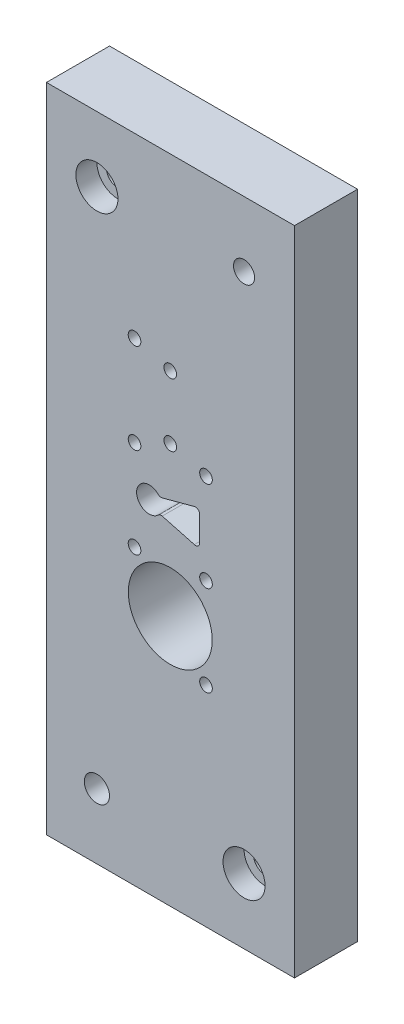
SolidWorks part; units mm, degrees
ref_plane "Plan de face" through (0, 0, 0) normal (0, 0, 1) x (1, 0, 0)
ref_plane "Plan de dessus" through (0, 0, 0) normal (0, 1, 0) x (1, 0, 0)
ref_plane "Plan de droite" through (0, 0, 0) normal (1, 0, 0) x (0, 0, -1)
sketch "Esquisse1" plane through (0, 0, 0) normal (0, 0, 1) x (1, 0, 0)
  line L0 (0, 115.0503) -> (0, -0.1136) construction
  line L1 (-30, -78) -> (-30, 78) construction
  line L2 (30, -78) -> (30, 78) construction
  line L3 (-29.5, -77.5) -> (-29.5, 77.5)
  line L4 (-30, 78) -> (4.5, 78) construction
  line L8 (29.5, -77.5) -> (29.5, 77.5)
  line L9 (-4.5, -78) -> (30, -78) construction
  line L40 (-29.5, -77.5) -> (29.5, -77.5)
  line L46 (29.5, 77.5) -> (-29.5, 77.5)
  circle A0 centre (-17.5, -62) radius 3.0035 construction
  circle A1 centre (17.5, 62) radius 2.5035 construction
  circle A2 centre (-17.5, -62) radius 3.0035
  circle A3 centre (17.5, 62) radius 2.5035
  dimension "D2" = 59
  dimension "D3" = 0.5
  dimension "D1" = 0.5
extrude "Extrusion1" add sketch "Esquisse1" along normal blind 15
hole_wizard "Chambrage pour vis à tête cylindrique à 6 pans creux (ou vis CHC) M51" positions "Esquisse3" profile "Esquisse2" counterbore size "M5" standard "Ansi Métrique"
sketch "Esquisse3" plane through (0, 0, 15) normal (0, 0, 1) x (1, 0, 0)
  point P0 (-17.5, 62)
  point P1 (17.5, -62)
sketch "Esquisse2" plane through (-17.5, 62, 15) normal (1, 0, 0) x (0, -1, 0)
  line L0 (0, 0) -> (0, 15)
  line L1 (0, 15) -> (2.75, 15)
  line L3 (2.75, 15) -> (2.75, 5)
  line L4 (2.75, 5) -> (5, 5)
  line L5 (5, 5) -> (5, 0)
  line L7 (5, 0) -> (0, 0)
  line L11 (0, -6.35) -> (0, 107.95) construction
  dimension "Diamètre du perçage jusqu'au prochain" = 5.5
  dimension "Profondeur du perçage jusqu'au prochain" = 15
  dimension "Diamètre du chambrage" = 10
  dimension "Profondeur du chambrage" = 5
sketch "Esquisse4" plane through (0, 0, 15) normal (0, 0, 1) x (1, 0, 0)
  line L18 (5.6886, 7.723) -> (-1.9653, 5.6722)
  line L19 (-1.9653, 1.9278) -> (5.6886, -0.123)
  line L20 (6.96, 0.8526) -> (6.96, 6.7474)
  line L21 (5.6886, 7.723) -> (-1.9653, 5.6722)
  line L22 (-1.9653, 1.9278) -> (5.6886, -0.123)
  line L23 (6.96, 0.8526) -> (6.96, 6.7474)
  circle A0 centre (-0.05, 32.8) radius 1.5035
  circle A1 centre (-0.05, 17.8) radius 1.5035
  circle A2 centre (-8.55, 35.2679) radius 1.5035
  circle A3 centre (8.45, 15.3321) radius 1.5035
  circle A4 centre (-8.55, 13.7679) radius 1.5035
  circle A5 centre (8.45, -6.1679) radius 1.5035
  circle A6 centre (-8.55, -7.7321) radius 1.5035
  circle A7 centre (8.45, -27.6679) radius 1.5035
  circle A8 centre (-8.55, 35.2679) radius 1.5 construction
  circle A9 centre (8.45, 15.3321) radius 1.5 construction
  circle A10 centre (-8.55, 13.7679) radius 1.5 construction
  circle A11 centre (8.45, -6.1679) radius 1.5 construction
  circle A12 centre (-8.55, -7.7321) radius 1.5 construction
  circle A13 centre (8.45, -27.6679) radius 1.5 construction
  circle A16 centre (-0.05, -17.7) radius 9.98
  circle A17 centre (-0.05, -17.7) radius 9.98
  arc A27 (-1.9653, 1.9278) -> (-2.9216, 1.6716) centre (-2.2216, 0.9716) ccw
  arc A28 (-2.9216, 5.9284) -> (-1.9653, 5.6722) centre (-2.2216, 6.6284) ccw
  arc A29 (-2.9216, 5.9284) -> (-2.9216, 1.6716) centre (-5.05, 3.8) ccw
  arc A30 (5.6886, -0.123) -> (6.96, 0.8526) centre (5.95, 0.8526) ccw
  arc A31 (6.96, 6.7474) -> (5.6886, 7.723) centre (5.95, 6.7474) ccw
  arc A32 (-1.9653, 1.9278) -> (-2.9216, 1.6716) centre (-2.2216, 0.9716) ccw
  arc A33 (-2.9216, 5.9284) -> (-1.9653, 5.6722) centre (-2.2216, 6.6284) ccw
  arc A34 (-2.9216, 5.9284) -> (-2.9216, 1.6716) centre (-5.05, 3.8) ccw
  arc A35 (5.6886, -0.123) -> (6.96, 0.8526) centre (5.95, 0.8526) ccw
  arc A36 (6.96, 6.7474) -> (5.6886, 7.723) centre (5.95, 6.7474) ccw
  dimension "D1" = 3.007
  dimension "D2" = 0.02
  dimension "D4" = 0.01
extrude "Enlèv. mat.-Extru.2" cut sketch "Esquisse4" against normal through all
